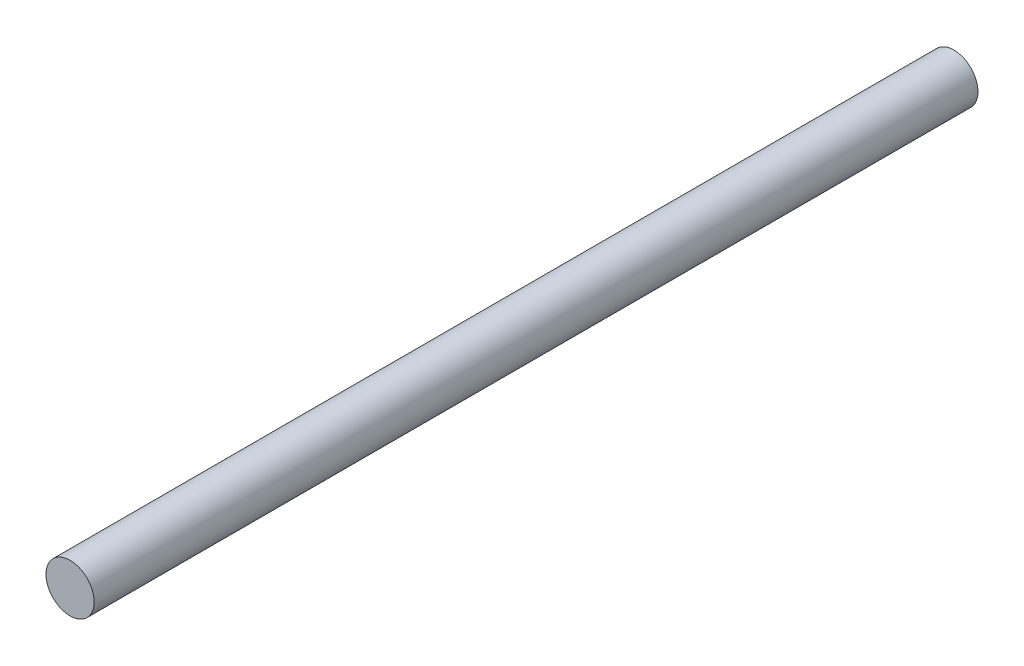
SolidWorks part; units mm, degrees
ref_plane "Front Plane" through (0, 0, 0) normal (0, 0, 1) x (1, 0, 0)
ref_plane "Top Plane" through (0, 0, 0) normal (0, 1, 0) x (1, 0, 0)
ref_plane "Right Plane" through (0, 0, 0) normal (1, 0, 0) x (0, 0, -1)
sketch "Sketch1" plane through (0, 0, 0) normal (0, 0, 1) x (1, 0, 0)
  circle A0 centre (0, 0) radius 0.381
extrude "Extrude1" add sketch "Sketch1" along normal blind 13.97
